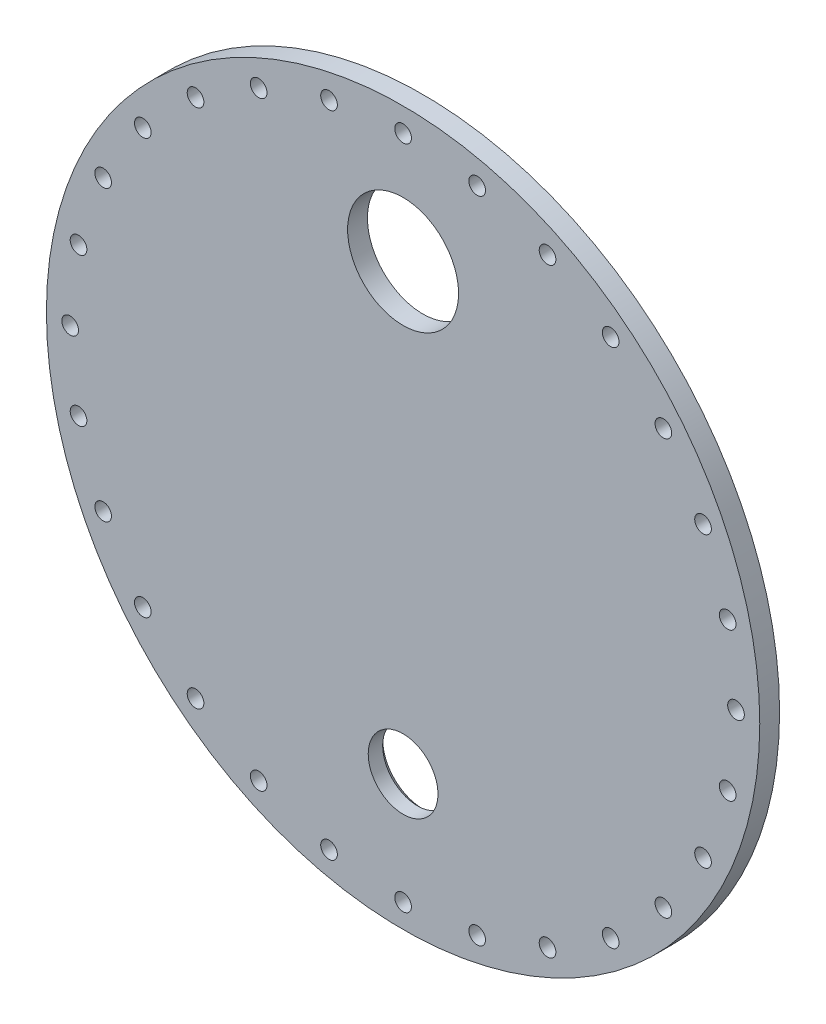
SolidWorks part; units mm, degrees
ref_plane "Alzado" through (0, 0, 0) normal (0, 0, 1) x (1, 0, 0)
ref_plane "Planta" through (0, 0, 0) normal (0, 1, 0) x (1, 0, 0)
ref_plane "Vista lateral" through (0, 0, 0) normal (1, 0, 0) x (0, 0, -1)
sketch "Croquis1" plane through (0, 0, 0) normal (0, 0, 1) x (1, 0, 0)
  circle A0 centre (0, 0) radius 225
extrude "Saliente-Extruir1" add sketch "Croquis1" along normal blind 12.5
sketch "Croquis3" plane through (0, 0, 12.5) normal (0, 0, 1) x (1, 0, 0)
  circle A0 centre (0, 210) radius 5.25
  dimension "D1" = 210
extrude "Cortar-Extruir4" cut sketch "Croquis3" against normal blind 12.5
pattern_circular "MatrizC1" count 28 over 360 about axis through (0, 0, 0) along (0, 0, 1) of "Cortar-Extruir4"
sketch "Croquis4" plane through (0, 0, 12.5) normal (0, 0, 1) x (1, 0, 0)
  circle A0 centre (0, 140) radius 35
  circle A1 centre (0, 0) radius 225
  circle A2 centre (0, 0) radius 225
  circle A3 centre (0, -140) radius 22
  dimension "D1" = 0
sketch "Croquis6" plane through (0, 0, 12.5) normal (0, 0, 1) x (1, 0, 0)
  line L0 (0, 210) -> (0, -212.9552) construction
  circle A0 centre (0, 140) radius 35
  dimension "D3" = 70
  dimension "D2" = 140
extrude "Cortar-Extruir11" cut sketch "Croquis6" against normal blind 12.5
hole_wizard "Refrentado para tornillo tapón con cabeza plana de clavija de M205" positions "Croquis3D4" profile "Croquis46" countersink size "M20" standard "Métrico Ansi"
sketch3d "Croquis3D4"
  point P1 (0, -140, 0)
  dimension "D1" = 140
sketch "Croquis46" plane through (0, -140, 0) normal (1, 0, 0) x (0, 1, 0)
  line L0 (0, 0) -> (0, 12.5)
  line L1 (0, 12.5) -> (22, 12.5)
  line L2 (22, 12.5) -> (22, 3.4)
  line L3 (22, 3.4) -> (25.4, 0)
  line L5 (25.4, 0) -> (0, 0)
  line L6 (-22, 3.4) -> (-25.4, 0) construction
  line L11 (0, -6.35) -> (0, 107.95) construction
  dimension "Diámetro de taladro hasta el siguiente" = 44
  dimension "Profundidad de taladro hasta el siguiente" = 12.5
  dimension "Diámetro de avellanado cercano" = 50.8
  dimension "Ángulo de avellanado cercano" = 90
